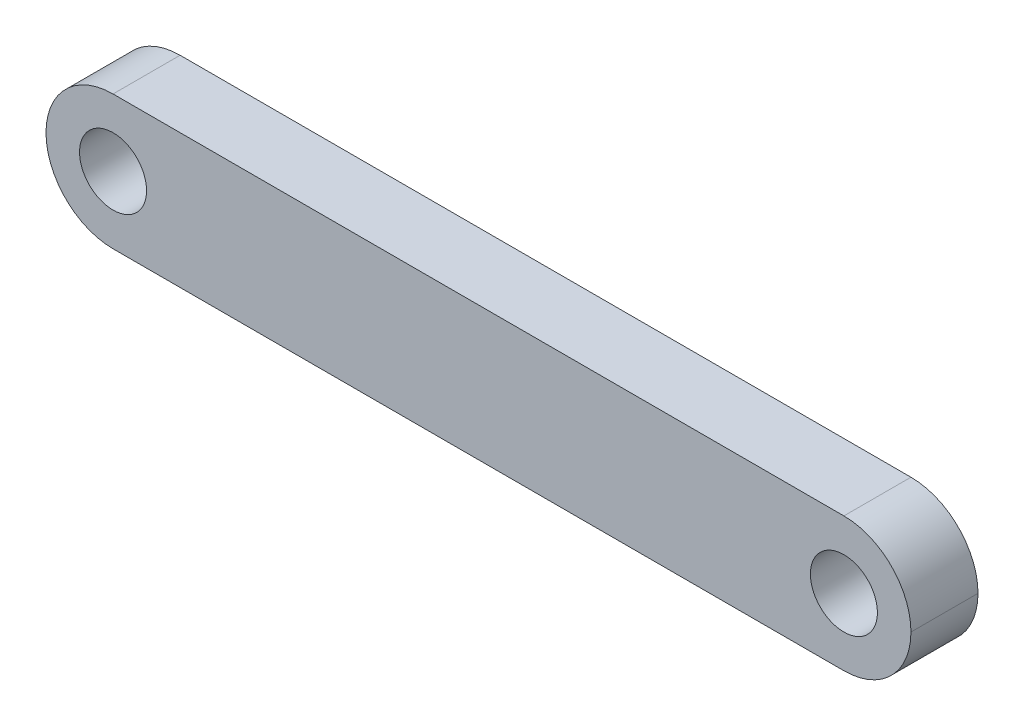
SolidWorks part; units mm, degrees
ref_plane "Front Plane" through (0, 0, 0) normal (0, 0, 1) x (1, 0, 0)
ref_plane "Top Plane" through (0, 0, 0) normal (0, 1, 0) x (1, 0, 0)
ref_plane "Right Plane" through (0, 0, 0) normal (1, 0, 0) x (0, 0, -1)
sketch "Sketch1" plane through (0, 0, 0) normal (0, 0, 1) x (1, 0, 0)
  line L1 (0, 0) -> (129, 0)
  line L2 (0, 0) -> (0, 20)
  line L3 (0, 20) -> (129, 20)
  line L4 (129, 0) -> (129, 20)
  dimension "D1" = 129
  dimension "D2" = 20
extrude "Boss-Extrude1" add sketch "Sketch1" along normal blind 10
fillet "Fillet1" radius 10 4 edges at (129, 0, 5) (129, 20, 5) (0, 0, 5) (0, 20, 5)
sketch "Sketch2" plane through (0, 0, 10) normal (0, 0, 1) x (1, 0, 0)
  line L0 (10, 0) -> (119, 0) construction
  circle A0 centre (10, 10) radius 5
  dimension "D1" = 10
  dimension "D2" = 10
  dimension "D3" = 10
extrude "Cut-Extrude1" cut sketch "Sketch2" against normal through all
sketch "Sketch3" plane through (0, 0, 10) normal (0, 0, 1) x (1, 0, 0)
  line L0 (10, 0) -> (119, 0) construction
  circle A0 centre (119, 10) radius 5
  dimension "D1" = 10
  dimension "D2" = 10
  dimension "D3" = 10
extrude "Cut-Extrude2" cut sketch "Sketch3" against normal through all
